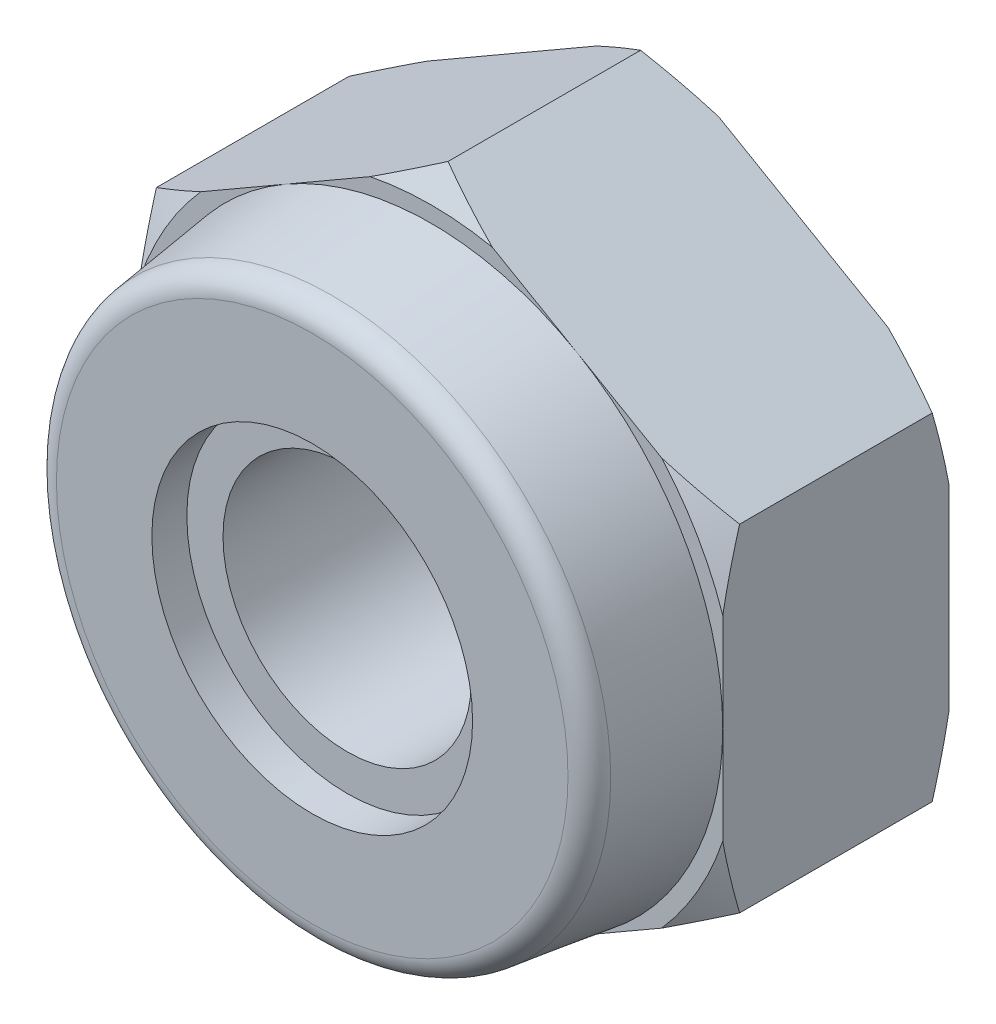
SolidWorks part; units mm, degrees
ref_plane "Front" through (0, 0, 0) normal (0, 0, 1) x (1, 0, 0)
ref_plane "Top" through (0, 0, 0) normal (0, 1, 0) x (1, 0, 0)
ref_plane "Right" through (0, 0, 0) normal (1, 0, 0) x (0, 0, -1)
sketch "BaseNutSke" plane through (0, 0, 0) normal (0, 0, 1) x (1, 0, 0)
  line L1 (6.35, -3.6662) -> (6.35, 3.6662)
  line L2 (6.35, 3.6662) -> (0, 7.3323)
  line L3 (0, 7.3323) -> (-6.35, 3.6662)
  line L4 (-6.35, 3.6662) -> (-6.35, -3.6662)
  line L5 (-6.35, -3.6662) -> (0, -7.3323)
  line L12 (0, -7.3323) -> (6.35, -3.6662)
  circle A0 centre (0, 0) radius 2.7051
  circle A2 centre (0, 0) radius 6.35 construction
  dimension "Tap_Drill" = 5.4102
  dimension "A" = 12.7
extrude "BaseNut" add sketch "BaseNutSke" against normal blind 4.9276
sketch "TorqEleSke" plane through (0, 0, 0) normal (0, 1, 0) x (0, 0, -1)
  line L0 (-9.4809, 0) -> (15.875, 0) construction
  line L1 (0, 0) -> (0, 6.35) construction
  line L2 (-1.8288, 3.4925) -> (-1.8288, 2.7051)
  line L3 (0, 2.7051) -> (0, 6.35)
  line L4 (0, 6.35) -> (-2.1561, 6.0661)
  line L5 (-1.8288, 2.7051) -> (0, 2.7051)
  line L6 (-1.8288, 3.4925) -> (-2.5908, 3.4925)
  line L7 (-2.5908, 3.4925) -> (-2.5908, 5.5704)
  line L10 (0, -6.35) -> (0, 0) construction
  line L11 (4.9276, -6.35) -> (4.9276, 0) construction
  arc A0 (-2.5908, 5.5704) -> (-2.1561, 6.0661) centre (-2.0908, 5.5704) cw
revolve "TorqueElement" add sketch "TorqEleSke" angle 360 about L0
sketch "Sketch3" plane through (0, 0, 0) normal (1, 0, 0) x (0, 0, -1)
  line L0 (4.9276, 6.6973) -> (4.561, 7.3323)
  line L1 (0, 7.3323) -> (0, 6.6973)
  line L2 (4.561, 7.3323) -> (4.9276, 7.3323)
  line L3 (4.9276, 7.3323) -> (4.9276, 6.6973)
  line L4 (0.3666, 7.3323) -> (0, 7.3323)
  line L5 (0, 6.6973) -> (0.3666, 7.3323)
  line L7 (0, 0) -> (38.6776, 0) construction
  line L9 (2.4638, 4.0415) -> (2.4638, 50004.0415) construction
  line L15 (4.9276, 7.3323) -> (0, 7.3323) construction
  point P23 (2.4638, 7.3323)
revolve "DoubleChamfer" cut sketch "Sketch3" angle 360 about L7
sketch "ThdSchSke" plane through (0, 0, 0) normal (0, 1, 0) x (1, 0, 0)
  line L0 (-3.175, 4.9276) -> (-2.7051, 5.1989)
  line L1 (-3.175, 4.9276) -> (-50003.175, 4.9276) construction
  line L2 (-2.7051, 5.1989) -> (-2.7051, 4.6563)
  line L3 (2.7051, 4.9276) -> (-2.7051, 4.9276) construction
  line L4 (-2.7051, 4.6563) -> (-3.175, 4.9276)
  line L6 (0, -1.4815) -> (0, -2.9874) construction
  line L7 (-2.7051, 4.9276) -> (-2.7051, -1.8288) construction
revolve "ThreadSchematic" cut sketch "ThdSchSke" angle 360 about L6
pattern_linear "ThdSchPat" [suppressed]
equation "\"Inset_Dia@TorqEleSke\" = \"ThreadSize@ThdSchSke\" * 1.1"
equation "\"D3@TorqEleSke\" = \"ThreadSize@ThdSchSke\" * .12"
equation "\"ChamferLen@Sketch3\"=\"ThreadSize@ThdSchSke\"*.1"
